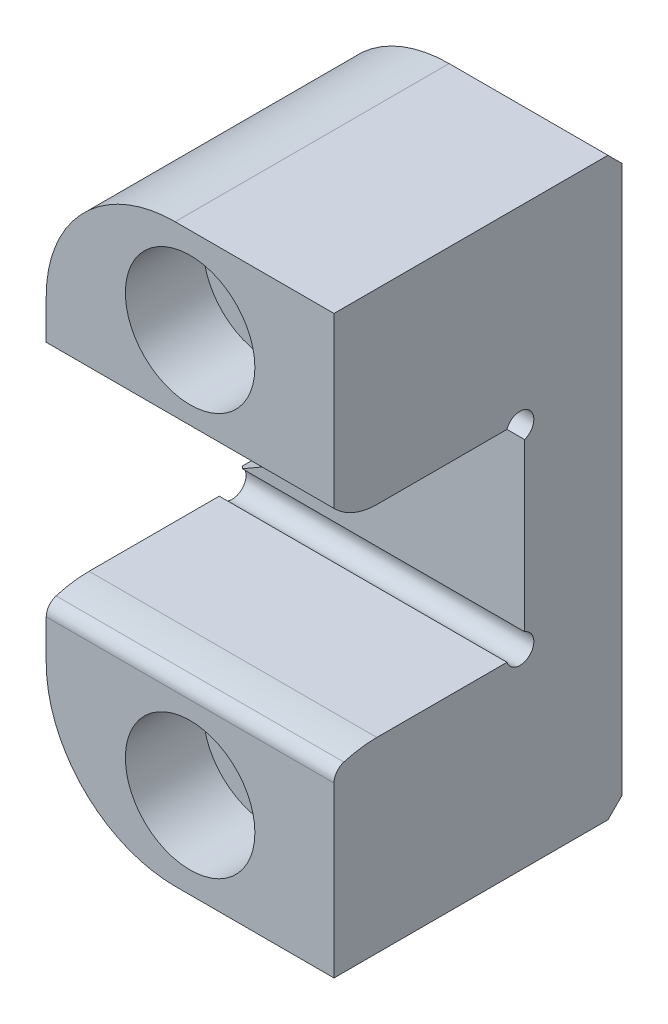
SolidWorks part; units mm, degrees
ref_plane "Front Plane" through (0, 0, 0) normal (0, 0, 1) x (1, 0, 0)
ref_plane "Top Plane" through (0, 0, 0) normal (0, 1, 0) x (1, 0, 0)
ref_plane "Right Plane" through (0, 0, 0) normal (1, 0, 0) x (0, 0, -1)
sketch "Sketch1" plane through (0, 0, 0) normal (1, 0, 0) x (0, 0, -1)
  line L0 (0, 0) -> (50000, 0) construction
  line L1 (0, 5.5626) -> (10.5156, 5.5626)
  line L2 (0, 15.875) -> (15.875, 15.875)
  line L3 (0, 15.875) -> (0, 5.5626)
  line L4 (0, -15.875) -> (15.875, -15.875)
  line L5 (15.875, 15.875) -> (15.875, -15.875)
  line L6 (10.5156, 5.5626) -> (10.5156, -5.5626)
  line L7 (10.5156, -5.5626) -> (0, -5.5626)
  line L9 (0, 8.7312) -> (0, -8.7312) construction
  line L10 (0, -5.5626) -> (0, -15.875)
  dimension "D1" = 15.875
  dimension "D2" = 31.75
  dimension "D3" = 10.5156
  dimension "D4" = 11.1252
extrude "Extrude1" add sketch "Sketch1" along normal mid plane 15.875
fillet "Fillet1" radius 7.112 2 edges at (-7.9375, -15.875, -7.9375) (-7.9375, 15.875, -7.9375)
sketch "Sketch2" plane through (-7.9375, 0, -15.875) normal (0, 0, 1) x (1, 0, 0)
  line L0 (0, 0) -> (50000, 0) construction
  line L1 (15.875, -15.875) -> (15.875, 15.875) construction
  line L2 (14.2875, 3.846) -> (17.4625, 5.679) construction
  line L3 (14.2875, 3.846) -> (14.2875, -3.846) construction
  line L4 (14.2875, -3.846) -> (17.4625, -5.679) construction
  line L5 (17.4625, 5.679) -> (17.4625, -5.679) construction
  line L6 (7.9375, 0) -> (7.9375, 50000) construction
  line L7 (-1.5875, 5.679) -> (-1.5875, -5.679)
  line L8 (1.5875, -3.846) -> (-1.5875, -5.679)
  line L9 (1.5875, 3.846) -> (1.5875, -3.846)
  line L10 (1.5875, 3.846) -> (-1.5875, 5.679)
  point P4 (15.875, 4.7625)
  point P10 (15.875, -4.7625)
  point P13 (0, -4.7625)
  point P14 (0, 4.7625)
  dimension "D1" = 9.525
  dimension "D2" = 1.5875
  dimension "D3" = 30
  dimension "D4" = 3.175
extrude "Cut-Extrude1" cut sketch "Sketch2" along normal through all
sketch "Sketch5" plane through (7.9375, 0, 0) normal (1, 0, 0) x (0, 0, -1)
  line L0 (0, 0) -> (50000, 0) construction
  line L1 (0, 5.5626) -> (10.5156, 5.5626) construction
  line L2 (0, 15.875) -> (0, 5.5626) construction
  line L3 (0, -5.5626) -> (0, -15.875) construction
  line L4 (-3.9878, -3.3836) -> (2.3622, -3.3836)
  line L5 (-3.9878, -3.3836) -> (-3.9878, -6.5586)
  line L6 (-3.9878, -6.5586) -> (0, -6.5586)
  line L7 (2.3622, -3.3836) -> (2.3622, -5.5626)
  line L8 (10.5156, -5.5626) -> (0, -5.5626) construction
  line L9 (2.3622, 3.3836) -> (2.3622, 5.5626)
  line L10 (-3.9878, 6.5586) -> (0, 6.5586)
  line L11 (-3.9878, 3.3836) -> (-3.9878, 6.5586)
  line L12 (-3.9878, 3.3836) -> (2.3622, 3.3836)
  arc A0 (0.5438, -5.8285) -> (2.3622, -5.5626) centre (2.3622, -11.9126) cw
  arc A1 (0, -6.5586) -> (0.5438, -5.8285) centre (0.762, -6.5586) cw
  arc A2 (0, 6.5586) -> (0.5438, 5.8285) centre (0.762, 6.5586) ccw construction
  arc A3 (0.5438, 5.8285) -> (2.3622, 5.5626) centre (2.3622, 11.9126) ccw construction
  arc A4 (0, 6.5586) -> (2.3622, 5.5626) centre (2.3622, 8.8618) ccw
  dimension "D1" = 0.762
  dimension "D2" = 6.35
  dimension "D3" = 3.175
  dimension "D4" = 6.35
  dimension "D5" = 2.3622
extrude "Cut-Extrude2" cut sketch "Sketch5" against normal through all
sketch "Sketch6" plane through (7.9375, 0, 0) normal (1, 0, 0) x (0, 0, -1)
  line L0 (0, 0) -> (50000, 0) construction
  line L3 (10.5156, 5.5626) -> (10.5156, -5.5626) construction
  line L4 (2.3622, 5.5626) -> (10.5156, 5.5626) construction
  circle A0 centre (10.2616, 5.3086) radius 0.762
  circle A1 centre (10.2616, -5.3086) radius 0.762
  dimension "D2" = 0.508
  dimension "D3" = 0.762
  dimension "D1" = 0.508
extrude "Cut-Extrude3" cut sketch "Sketch6" against normal through all
hole_wizard "#6 CBORE" positions "Sketch4" profile "Sketch3" counterbore size "#6" standard "Ansi Inch"
sketch "Sketch4" plane through (0, 0, 0) normal (0, 0, 1) x (1, 0, 0)
  line L0 (0, 0) -> (0, 50000) construction
  line L1 (0, 0) -> (50000, 0) construction
  point P0 (0, 11.1125)
  point P12 (0, -11.1125)
  dimension "D1" = 22.225
sketch "Sketch3" plane through (0, 11.1125, 0) normal (1, 0, 0) x (0, -1, 0)
  line L0 (0, 0) -> (0, 15.875)
  line L1 (0, 15.875) -> (2.1526, 15.875)
  line L3 (2.1526, 15.875) -> (2.1527, 4.3002)
  line L4 (2.1527, 4.3002) -> (3.5725, 4.3002)
  line L5 (3.5725, 4.3002) -> (3.5725, 0)
  line L7 (3.5725, 0) -> (0, 0)
  line L11 (0, -6.35) -> (0, 107.95) construction
  dimension "Thru Hole Dia." = 4.3053
  dimension "Thru Hole Depth" = 15.875
  dimension "C'Bore Dia." = 7.145
  dimension "C'Bore Depth" = 4.3002
chamfer "Chamfer3" distance 3.81 angle 15 1 edges at (-6.35, 0, -10.5156)
chamfer "Chamfer1" distance 0.762 angle 45 6 edges at (-7.9375, -6.7627, -15.875) (-5.8544, -13.7919, -15.875) (3.556, -15.875, -15.875) (3.556, 15.875, -15.875) (-7.9375, 6.7628, -15.875) (-5.8544, 13.7919, -15.875)
